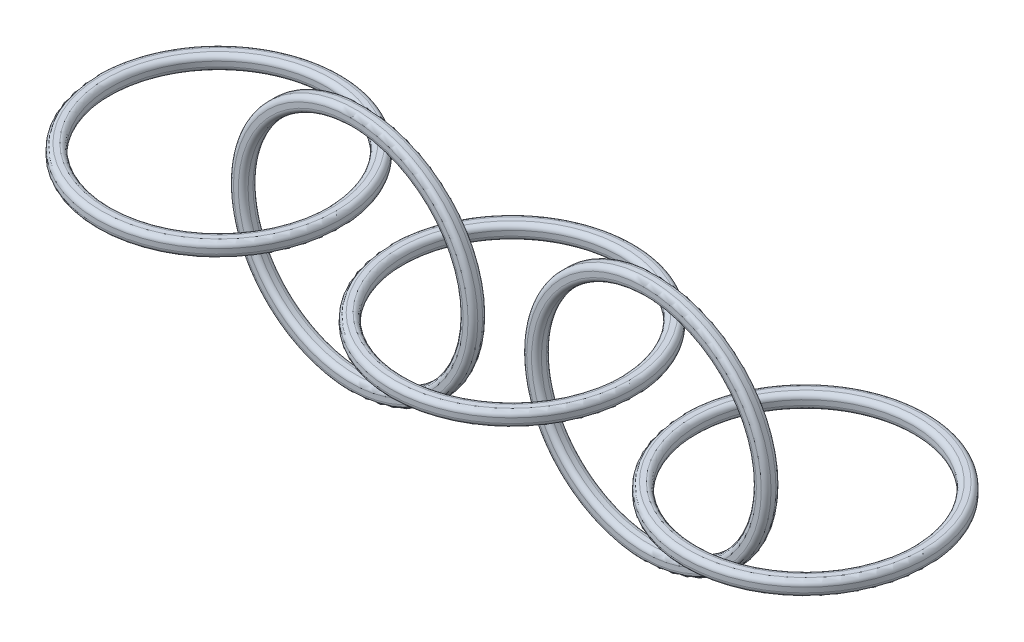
SolidWorks part; units mm, degrees
ref_plane "Front Plane" through (0, 0, 0) normal (0, 0, 1) x (1, 0, 0)
ref_plane "Top Plane" through (0, 0, 0) normal (0, 1, 0) x (1, 0, 0)
ref_plane "Right Plane" through (0, 0, 0) normal (1, 0, 0) x (0, 0, -1)
sketch "Sketch1" plane through (0, 0, 0) normal (0, 1, 0) x (1, 0, 0)
  circle A0 centre (0, 0) radius 25
  circle A1 centre (0, 0) radius 22
  dimension "D1" = 50
  dimension "D2" = 44
extrude "Boss-Extrude1" add sketch "Sketch1" along normal blind 3
sketch "Sketch5" plane through (0, 0, 0) normal (0, 1, 0) x (1, 0, 0)
  line L0 (0, 0) -> (-60, 0) construction
  circle A0 centre (-60, 0) radius 25
  circle A1 centre (-60, 0) radius 22
  dimension "D2" = 50
  dimension "D3" = 44
  dimension "D1" = 60
extrude "Boss-Extrude5" add sketch "Sketch5" along normal blind 3 separate body
sketch "Sketch6" plane through (0, 0, 0) normal (0, 1, 0) x (1, 0, 0)
  line L0 (-60, 0) -> (-120, 0) construction
  circle A0 centre (-120, 0) radius 25
  circle A1 centre (-120, 0) radius 22
  dimension "D2" = 50
  dimension "D3" = 44
  dimension "D1" = 60
extrude "Boss-Extrude6" add sketch "Sketch6" along normal blind 3 separate body
sketch "Sketch7" plane through (0, 0, 0) normal (0, 0, 1) x (1, 0, 0)
  line L0 (-120, 0) -> (-60, 0) construction
  line L1 (-145, 0) -> (-95, 0) construction
  line L2 (-85, 0) -> (-35, 0) construction
  circle A0 centre (-90, 0) radius 25
  circle A1 centre (-90, 0) radius 22
  dimension "D1" = 50
  dimension "D2" = 44
extrude "Boss-Extrude7" add sketch "Sketch7" along normal blind 3 separate body
sketch "Sketch8" plane through (0, 0, 0) normal (0, 0, 1) x (1, 0, 0)
  line L0 (-60, 0) -> (0, 0) construction
  line L1 (-85, 0) -> (-35, 0) construction
  circle A0 centre (-30, 0) radius 25
  circle A1 centre (-30, 0) radius 22
  dimension "D1" = 50
  dimension "D2" = 44
extrude "Boss-Extrude8" add sketch "Sketch8" along normal blind 3 separate body
fillet "Fillet1" radius 1 1 edges at (-120, 3, 22)
fillet "Fillet2" radius 1 1 edges at (-120, 3, 25)
fillet "Fillet3" radius 1 1 edges at (-120, 0, 25)
fillet "Fillet4" radius 1 1 edges at (-120, 0, 22)
fillet "Fillet5" radius 1 1 edges at (-65, 0, 3)
fillet "Fillet6" radius 1 1 edges at (-65, 0, 0)
fillet "Fillet7" radius 1 1 edges at (-68, 0, 0)
fillet "Fillet8" radius 1 1 edges at (-68, 0, 3)
fillet "Fillet9" radius 1 1 edges at (-60, 3, 22)
fillet "Fillet10" radius 1 1 edges at (-60, 3, 25)
fillet "Fillet11" radius 1 1 edges at (-60, 0, 25)
fillet "Fillet12" radius 1 1 edges at (-60, 0, 22)
fillet "Fillet13" radius 1 1 edges at (-8, 0, 3)
fillet "Fillet14" radius 1 1 edges at (-5, 0, 3)
fillet "Fillet15" radius 1 1 edges at (-5, 0, 0)
fillet "Fillet16" radius 1 1 edges at (-8, 0, 0)
fillet "Fillet17" radius 1 1 edges at (0, 3, 22)
fillet "Fillet18" radius 1 1 edges at (0, 3, 25)
fillet "Fillet19" radius 1 1 edges at (0, 0, 25)
fillet "Fillet20" radius 1 1 edges at (0, 0, 22)
